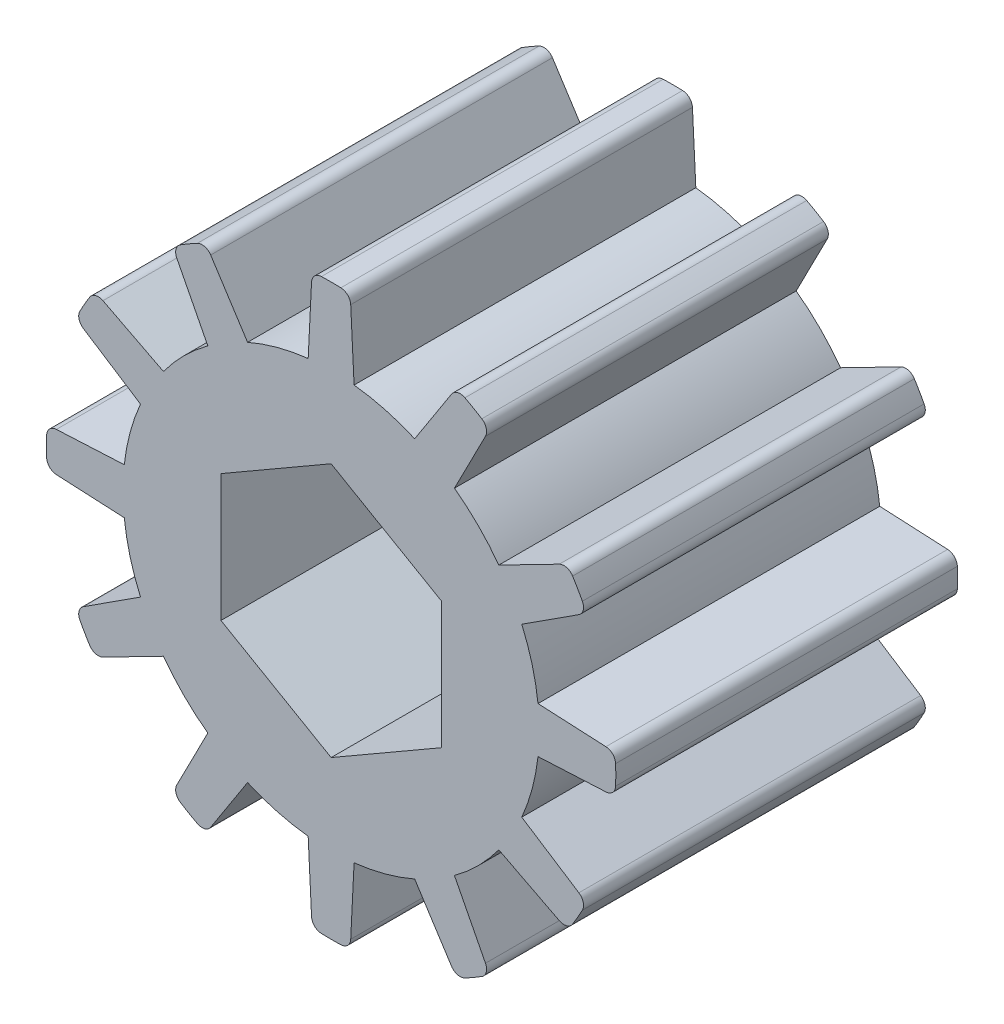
SolidWorks part; units mm, degrees
ref_plane "Alzado" through (0, 0, 0) normal (0, 0, 1) x (1, 0, 0)
ref_plane "Planta" through (0, 0, 0) normal (0, 1, 0) x (1, 0, 0)
ref_plane "Vista lateral" through (0, 0, 0) normal (1, 0, 0) x (0, 0, -1)
sketch "Croquis1" plane through (0, 0, 0) normal (0, 0, 1) x (1, 0, 0)
  line L0 (0, 0) -> (0, 4.6049) construction
  line L1 (0.375, 5.5679) -> (0.45, 4.0556)
  line L2 (-0.375, 5.5679) -> (-0.45, 4.0556)
  line L3 (2.4592, 5.0094) -> (1.6381, 3.7373)
  line L4 (3.1087, 4.6344) -> (2.4175, 3.2873)
  line L5 (4.6344, 3.1087) -> (3.2873, 2.4175)
  line L6 (5.0094, 2.4592) -> (3.7373, 1.6381)
  line L7 (5.5679, 0.375) -> (4.0556, 0.45)
  line L8 (5.5679, -0.375) -> (4.0556, -0.45)
  line L9 (5.0094, -2.4592) -> (3.7373, -1.6381)
  line L10 (4.6344, -3.1087) -> (3.2873, -2.4175)
  line L11 (3.1087, -4.6344) -> (2.4175, -3.2873)
  line L12 (2.4592, -5.0094) -> (1.6381, -3.7373)
  line L13 (0.375, -5.5679) -> (0.45, -4.0556)
  line L14 (-0.375, -5.5679) -> (-0.45, -4.0556)
  line L15 (-2.4592, -5.0094) -> (-1.6381, -3.7373)
  line L16 (-3.1087, -4.6344) -> (-2.4175, -3.2873)
  line L17 (-4.6344, -3.1087) -> (-3.2873, -2.4175)
  line L18 (-5.0094, -2.4592) -> (-3.7373, -1.6381)
  line L19 (-5.5679, -0.375) -> (-4.0556, -0.45)
  line L20 (-5.5679, 0.375) -> (-4.0556, 0.45)
  line L21 (-5.0094, 2.4592) -> (-3.7373, 1.6381)
  line L22 (-4.6344, 3.1087) -> (-3.2873, 2.4175)
  line L23 (-3.1087, 4.6344) -> (-2.4175, 3.2873)
  line L24 (-2.4592, 5.0094) -> (-1.6381, 3.7373)
  circle A0 centre (0, 0) radius 1.85
  arc A1 (1.6381, 3.7373) -> (0.45, 4.0556) centre (0, 0) ccw
  arc A2 (3.1087, 4.6344) -> (2.4592, 5.0094) centre (0, 0) ccw
  arc A3 (5.0094, 2.4592) -> (4.6344, 3.1087) centre (0, 0) ccw
  arc A4 (5.5679, -0.375) -> (5.5679, 0.375) centre (0, 0) ccw
  arc A5 (4.6344, -3.1087) -> (5.0094, -2.4592) centre (0, 0) ccw
  arc A6 (2.4592, -5.0094) -> (3.1087, -4.6344) centre (0, 0) ccw
  arc A7 (-0.375, -5.5679) -> (0.375, -5.5679) centre (0, 0) ccw
  arc A8 (-3.1087, -4.6344) -> (-2.4592, -5.0094) centre (0, 0) ccw
  arc A9 (-5.0094, -2.4592) -> (-4.6344, -3.1087) centre (0, 0) ccw
  arc A10 (-5.5679, 0.375) -> (-5.5679, -0.375) centre (0, 0) ccw
  arc A11 (-4.6344, 3.1087) -> (-5.0094, 2.4592) centre (0, 0) ccw
  arc A12 (-2.4592, 5.0094) -> (-3.1087, 4.6344) centre (0, 0) ccw
  arc A13 (0.375, 5.5679) -> (-0.375, 5.5679) centre (0, 0) ccw
  arc A14 (3.2873, 2.4175) -> (2.4175, 3.2873) centre (0, 0) ccw
  arc A15 (4.0556, 0.45) -> (3.7373, 1.6381) centre (0, 0) ccw
  arc A16 (3.7373, -1.6381) -> (4.0556, -0.45) centre (0, 0) ccw
  arc A17 (2.4175, -3.2873) -> (3.2873, -2.4175) centre (0, 0) ccw
  arc A18 (0.45, -4.0556) -> (1.6381, -3.7373) centre (0, 0) ccw
  arc A19 (-1.6381, -3.7373) -> (-0.45, -4.0556) centre (0, 0) ccw
  arc A20 (-3.2873, -2.4175) -> (-2.4175, -3.2873) centre (0, 0) ccw
  arc A21 (-4.0556, -0.45) -> (-3.7373, -1.6381) centre (0, 0) ccw
  arc A22 (-3.7373, 1.6381) -> (-4.0556, 0.45) centre (0, 0) ccw
  arc A23 (-2.4175, 3.2873) -> (-3.2873, 2.4175) centre (0, 0) ccw
  arc A24 (-0.45, 4.0556) -> (-1.6381, 3.7373) centre (0, 0) ccw
  dimension "D1" = 0.9
  dimension "D2" = 3.7
  dimension "D4" = 1.5
  dimension "D3" = 0.75
  dimension "D6" = 1.23
  dimension "D5" = 12
extrude "Saliente-Extruir1" add sketch "Croquis1" along normal blind 6.7
sketch "Croquis10" plane through (0, 0, 0) normal (0, 0, -1) x (-1, 0, 0)
  line L1 (0, -2.4942) -> (2.16, -1.2471)
  line L2 (2.16, -1.2471) -> (2.16, 1.2471)
  line L3 (2.16, 1.2471) -> (0, 2.4942)
  line L4 (0, 2.4942) -> (-2.16, 1.2471)
  line L5 (-2.16, 1.2471) -> (-2.16, -1.2471)
  line L6 (-2.16, -1.2471) -> (0, -2.4942)
  circle A0 centre (0, 0) radius 2.16 construction
  dimension "D1" = 4.32
extrude "Cortar-Extruir3" cut sketch "Croquis10" against normal through all
fillet "Redondeo1" radius 0.2 24 edges at (5.5679, -0.375, 3.35) (-2.4592, -5.0094, 3.35) (-3.1087, -4.6344, 3.35) (0.375, -5.5679, 3.35) (-0.375, -5.5679, 3.35) (3.1087, -4.6344, 3.35) (2.4592, -5.0094, 3.35) (5.0094, -2.4592, 3.35) (4.6344, -3.1087, 3.35) (-4.6344, -3.1087, 3.35) (-5.0094, -2.4592, 3.35) (-5.5679, -0.375, 3.35) (-5.5679, 0.375, 3.35) (-5.0094, 2.4592, 3.35) (-4.6344, 3.1087, 3.35) (-3.1087, 4.6344, 3.35) (-2.4592, 5.0094, 3.35) (5.5679, 0.375, 3.35) (5.0094, 2.4592, 3.35) (4.6344, 3.1087, 3.35) (3.1087, 4.6344, 3.35) (2.4592, 5.0094, 3.35) (0.375, 5.5679, 3.35) (-0.375, 5.5679, 3.35)
